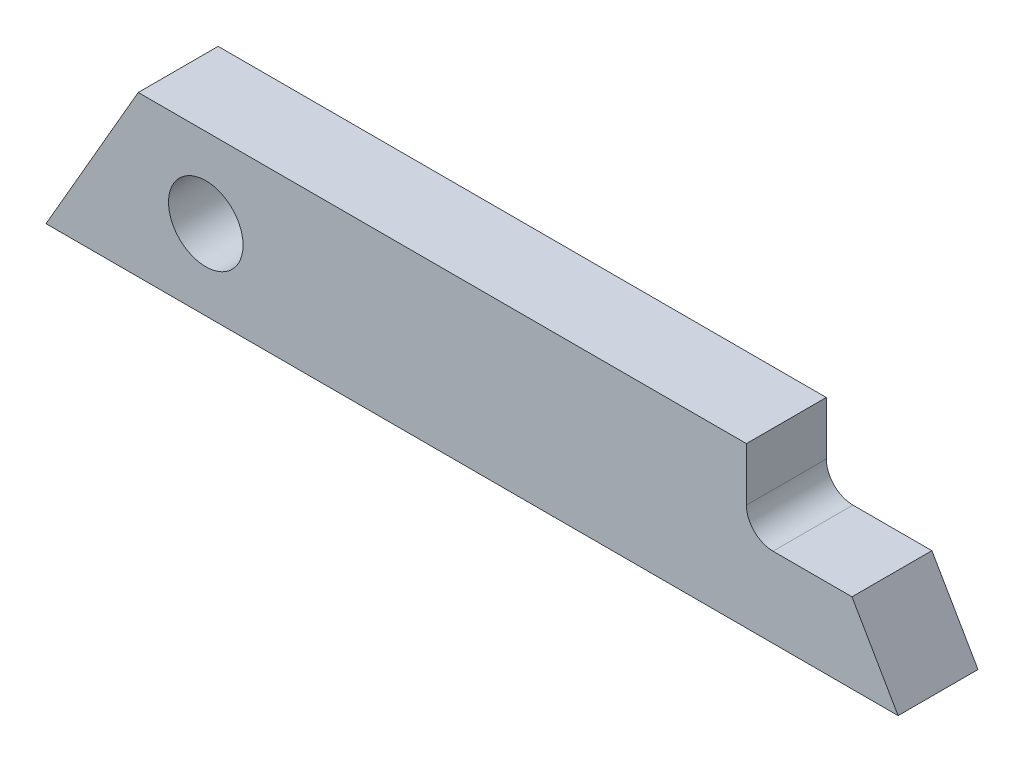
SolidWorks part; units mm, degrees
ref_plane "Ebene vorne" through (0, 0, 0) normal (0, 0, 1) x (1, 0, 0)
ref_plane "Ebene oben" through (0, 0, 0) normal (0, 1, 0) x (1, 0, 0)
ref_plane "Ebene rechts" through (0, 0, 0) normal (1, 0, 0) x (0, 0, -1)
sketch "Skizze1" plane through (0, 0, 0) normal (0, 0, 1) x (1, 0, 0)
  line L0 (0, 0) -> (0, 30)
  line L1 (0, 30) -> (142.6795, 30)
  line L2 (160, 0.0767) -> (160, 0)
  line L3 (160, 0) -> (0, 0)
  line L4 (17.3205, 30) -> (0, 0)
  line L5 (160, 0) -> (142.6795, 30)
  line L6 (131.5148, 30) -> (131.5148, 15)
  line L7 (131.5148, 15) -> (151.3397, 15)
  line L8 (136.5148, 20) -> (136.5148, 15) construction
  line L9 (136.5148, 20) -> (131.5148, 20) construction
  circle A0 centre (136.5148, 20) radius 5
  dimension "D2" = 160
  dimension "D3" = 5
extrude "Aufsatz-Linear austragen1" add sketch "Skizze1" along normal blind 15
hole_wizard "Ø14.0 (14) Durchmesser Bohrung1" positions "Skizze8" profile "Skizze7" hole size "Ø14.0" standard "DIN"
sketch "Skizze8" plane through (0, 0, 15) normal (0, 0, 1) x (1, 0, 0)
  line L0 (160, 0) -> (0, 0) construction
  point P0 (30, 15)
  dimension "D1" = 30
  dimension "D2" = 15
sketch "Skizze7" plane through (30, 15, 15) normal (1, 0, 0) x (0, -1, 0)
  line L0 (0, 0) -> (0, 19.206)
  line L1 (0, 19.206) -> (7, 15)
  line L2 (7, 15) -> (7, 0)
  line L5 (7, 0) -> (0, 0)
  line L10 (0, 19.206) -> (-7, 15) construction
  line L11 (0, -6.35) -> (0, 107.95) construction
  dimension "Bohrerdurchmesser" = 14
  dimension "Bohrungstiefe" = 15
  dimension "Spitzenwinkel" = 118
